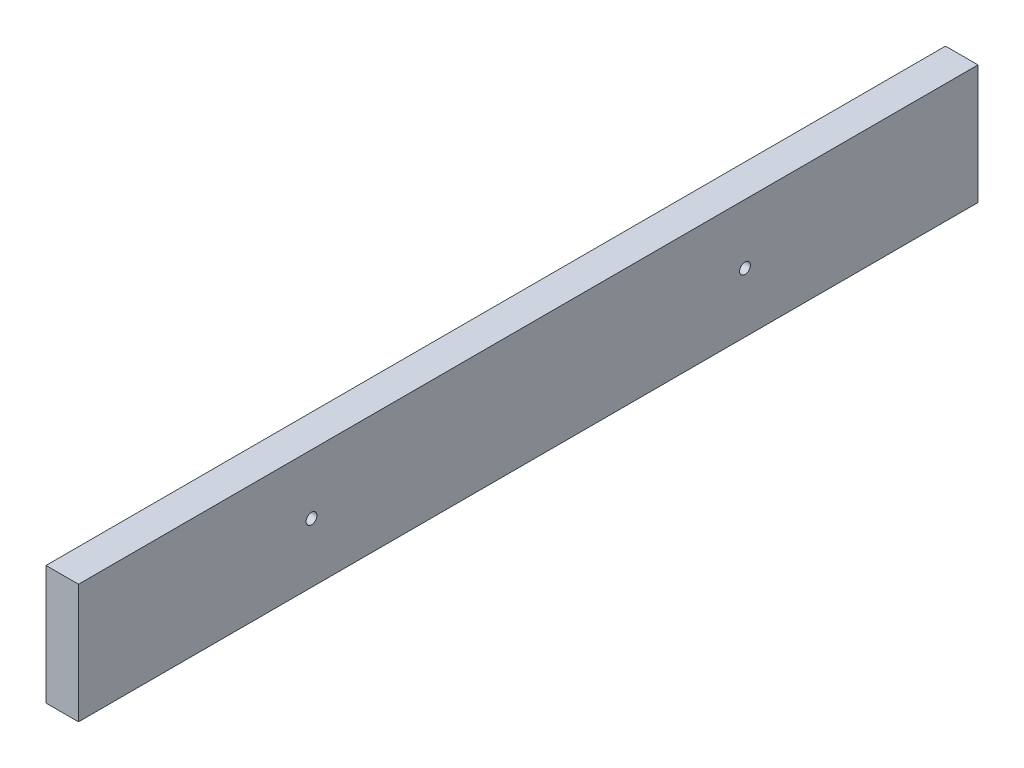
SolidWorks part; units mm, degrees
ref_plane "Front Plane" through (0, 0, 0) normal (0, 0, 1) x (1, 0, 0)
ref_plane "Top Plane" through (0, 0, 0) normal (0, 1, 0) x (1, 0, 0)
ref_plane "Right Plane" through (0, 0, 0) normal (1, 0, 0) x (0, 0, -1)
sketch "Sketch2" plane through (0, 0, 0) normal (0, 0, 1) x (1, 0, 0)
  line L1 (-19.05, 69.85) -> (19.05, 69.85)
  line L2 (-19.05, 69.85) -> (-19.05, -69.85)
  line L3 (-19.05, -69.85) -> (19.05, -69.85)
  line L4 (19.05, 69.85) -> (19.05, -69.85)
  line L5 (-19.05, 69.85) -> (19.05, -69.85) construction
  line L6 (-19.05, -69.85) -> (19.05, 69.85) construction
  point P0 (0, 0)
extrude "Boss-Extrude1" add sketch "Sketch2" along normal blind 1054.1
sketch "Sketch3" plane through (-19.05, 0, 0) normal (-1, 0, 0) x (0, 0, 1)
  line L0 (527.05, 69.85) -> (527.05, -69.85) construction
  line L1 (1054.1, 69.85) -> (0, 69.85) construction
  line L2 (1054.1, -69.85) -> (0, -69.85) construction
  circle A0 centre (273.05, 0) radius 6.35
  circle A1 centre (781.05, 0) radius 6.35
  dimension "D2" = 12.7
  dimension "D1" = 508
extrude "Cut-Extrude1" cut sketch "Sketch3" against normal through all
equation "\"system_width\"= 7ft + 10 "
equation "\"system_length\"= 95.5"
equation "\"module_board_length\"= 11.25in"
equation "\"module_board_width\"= 1.5in"
equation "\"step_board_length\"= 5.5in"
equation "\"step_board_width\"= 1.5in"
equation "\"module_lip_width\"= 1.5in"
equation "\"module_trim_thickness\"= 1in"
equation "\"module_width\"= (\"system_width\" -  2* \"module_trim_thickness\") / 2"
equation "\"module_board_short_depth\"= \"module_width\" - ( 2 * \"module_board_width\" ) - \"module_lip_width\""
equation "\"module_board_hole\"= 0.5in"
equation "\"module_board_hole_seperation\"= 20in"
equation "\"system_step_length\"= 2ft+11.5"
equation "\"system_top_length\"= \"system_length\" - \"system_step_length\""
equation "\"module_top_thickness\"= 0.75in"
equation "\"module_trim_height\"= 14in"
equation "\"module_top_overhang\"= 4.5in"
equation "\"module_trim_angle\"= 45deg"
equation "\"module_length\"= (\"system_top_length\" - \"module_trim_thickness\")/ 2"
equation "\"module_board_long_depth\"= \"module_length\" - \"module_lip_width\""
equation "\"module_board_hole_position\"= ( ( \"module_width\" - \"module_board_hole_seperation\" ) / 2 ) + \"module_board_width\"/2"
equation "\"step_module_width\"= \"module_width\""
equation "\"step_module_length\"= \"system_step_length\" - \"module_trim_thickness\""
equation "\"step_board_short_depth\"= \"step_module_length\" - \"module_lip_width\""
equation "\"step_board_long_depth\"= \"step_module_width\" - (2 * \"module_board_width\") - \"module_lip_width\""
equation "\"D2@Sketch2\"=\"step_board_length\""
equation "\"D1@Sketch2\"=\"step_board_width\""
equation "\"D1@Boss-Extrude1\"=\"step_board_long_depth\""
